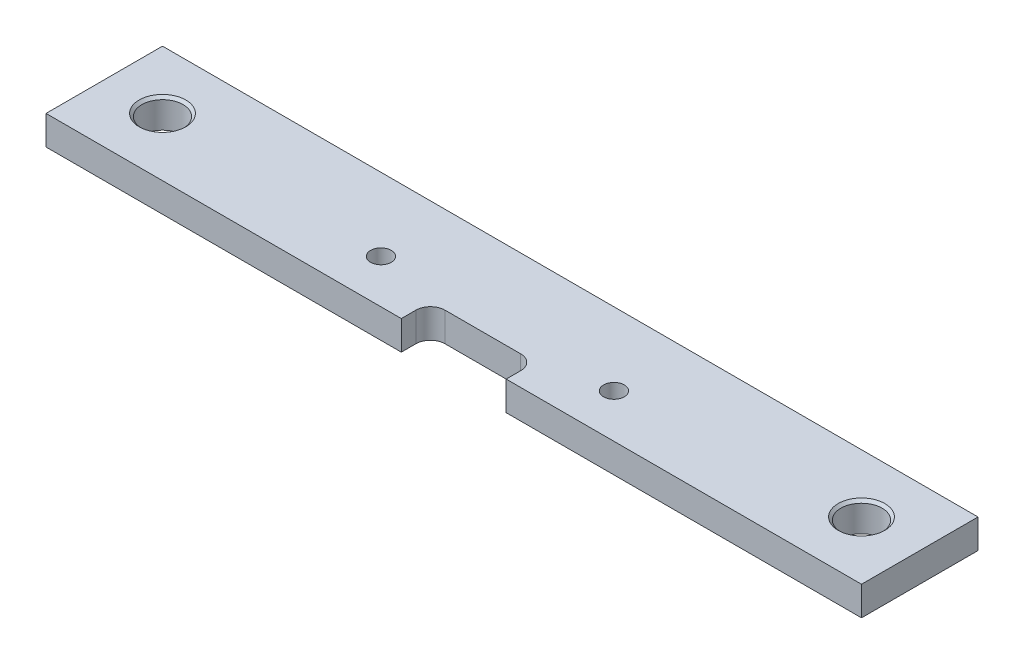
SolidWorks part; units mm, degrees
ref_plane "Front" through (0, 0, 0) normal (0, 0, 1) x (1, 0, 0)
ref_plane "Top" through (0, 0, 0) normal (0, 1, 0) x (1, 0, 0)
ref_plane "Right" through (0, 0, 0) normal (1, 0, 0) x (0, 0, -1)
sketch "Sketch24" plane through (0, 0, 0) normal (0, 1, 0) x (1, 0, 0)
  line L1 (-44.45, 6.35) -> (44.45, 6.35)
  line L2 (-44.45, 6.35) -> (-44.45, -6.35)
  line L3 (-44.45, -6.35) -> (44.45, -6.35)
  line L4 (44.45, 6.35) -> (44.45, -6.35)
  line L5 (-44.45, 6.35) -> (44.45, -6.35) construction
  line L6 (-44.45, -6.35) -> (44.45, 6.35) construction
  point P0 (0, 0)
  dimension "D1" = 88.9
  dimension "D2" = 12.7
extrude "Boss-Extrude3" add sketch "Sketch24" along normal blind 3.175
hole_wizard "#8 Clearance Hole1" positions "Sketch26" profile "Sketch27" hole size "#8" standard "Ansi Inch"
sketch "Sketch26" plane through (0, 3.175, 0) normal (0, 1, 0) x (-1, 0, 0)
  point P0 (38.1, 0)
  point P1 (-38.1, 0)
  dimension "D1" = 38.1
  dimension "D2" = 38.1
sketch "Sketch27" plane through (-38.1, 3.175, 0) normal (1, 0, 0) x (0, 0, 1)
  line L0 (0, 0) -> (0, 3.175)
  line L1 (0, 3.175) -> (2.2479, 3.175)
  line L2 (2.2479, 3.175) -> (2.2479, 0.2921)
  line L3 (2.2479, 0.2921) -> (2.54, 0)
  line L5 (2.54, 0) -> (0, 0)
  line L6 (-2.2479, 0.2921) -> (-2.54, 0) construction
  line L11 (0, -6.35) -> (0, 107.95) construction
  dimension "Thru Hole Dia." = 4.4958
  dimension "Thru Hole Depth" = 3.175
  dimension "Near C'Sink Dia." = 5.08
  dimension "Near C'Sink Angle" = 90
hole_wizard "#4-40 Tapped Hole2" positions "Sketch29" profile "Sketch28" tap size "#4-40" standard "Ansi Inch"
sketch "Sketch29" plane through (0, 3.175, 0) normal (0, 1, 0) x (-1, 0, 0)
  point P0 (12.7, 1.5875)
  point P1 (-12.7, 1.5875)
  dimension "D1" = 1.5875
  dimension "D2" = 12.7
  dimension "D3" = 12.7
sketch "Sketch28" plane through (-12.7, 3.175, 1.5875) normal (1, 0, 0) x (0, 0, 1)
  line L0 (0, 0) -> (0, 3.175)
  line L1 (0, 3.175) -> (1.1303, 3.175)
  line L2 (1.1303, 3.175) -> (1.1303, 0)
  line L5 (1.1303, 0) -> (0, 0)
  line L11 (0, -6.35) -> (0, 107.95) construction
  dimension "Thread Major Dia." = 2.2606
  dimension "Thru Tap Drill Depth" = 3.175
sketch "Sketch30" plane through (0, 3.175, 0) normal (0, 1, 0) x (1, 0, 0)
  line L0 (-44.45, -6.35) -> (44.45, -6.35) construction
  line L1 (-5.715, -3.175) -> (5.715, -3.175)
  line L2 (-5.715, -3.175) -> (-5.715, -9.525)
  line L3 (-5.715, -9.525) -> (5.715, -9.525)
  line L4 (5.715, -3.175) -> (5.715, -9.525)
  line L5 (-5.715, -3.175) -> (5.715, -9.525) construction
  line L6 (-5.715, -9.525) -> (5.715, -3.175) construction
  point P0 (0, -6.35)
  dimension "D1" = 11.43
  dimension "D2" = 6.35
extrude "Cut-Extrude6" cut sketch "Sketch30" against normal through all
fillet "Fillet2" radius 1.5875 2 edges at (5.715, 1.5875, 3.175) (-5.715, 1.5875, 3.175)
sketch "Sketch32" plane through (0, 0, 0) normal (0, 0, 1) x (1, 0, 0)
  line L0 (0, 0) -> (0, 3.175)
  line L1 (0, 3.175) -> (23.7666, 3.175)
  line L2 (23.7666, 3.175) -> (44.45, 15.6029)
  line L4 (44.45, 15.6029) -> (65.1334, 3.175)
  line L5 (65.1334, 3.175) -> (88.9, 3.175)
  line L6 (88.9, 3.175) -> (88.9, 0)
  line L7 (88.9, 0) -> (0, 0)
  dimension "D1" = 3.175
  dimension "D2" = 149
  dimension "D3" = 88.9
  dimension "D5" = 24.13
extrude "Boss-Extrude4" [suppressed] add sketch "Sketch32" along normal blind 12.7
hole_wizard "#8 Clearance Hole2" positions "Sketch35" profile "Sketch34" hole size "#8" standard "Ansi Inch"
sketch "Sketch35" [suppressed] plane through (0, 3.175, 0) normal (0, 1, 0) x (-1, 0, 0)
  line L7 (0, 6.35) -> (-23.7666, 6.35) construction
  line L8 (0, 12.7) -> (0, 0) construction
  line L9 (-23.7666, 12.7) -> (-23.7666, 0) construction
  line L11 (-44.45, 0) -> (-44.45, 12.7) construction
  line L15 (-6.35, 6.35) -> (-44.45, 6.35) construction
  line L17 (-44.45, 6.35) -> (-82.55, 6.35) construction
  point P0 (-6.35, 6.35)
  point P1 (-82.55, 6.35)
  dimension "D1" = 76.2
sketch "Sketch34" plane through (6.35, 3.175, 6.35) normal (1, 0, 0) x (0, 0, 1)
  line L0 (0, 0) -> (0, 3.175)
  line L1 (0, 3.175) -> (2.2479, 3.175)
  line L2 (2.2479, 3.175) -> (2.2479, 0)
  line L5 (2.2479, 0) -> (0, 0)
  line L11 (0, -6.35) -> (0, 107.95) construction
  dimension "Thru Hole Dia." = 4.4958
  dimension "Thru Hole Depth" = 3.175
sketch "Sketch40" [suppressed] plane through (0, 0, 12.7) normal (0, 0, 1) x (1, 0, 0)
  line L0 (44.45, 0) -> (44.45, 9.7622) construction
  line L1 (36.83, 0) -> (52.07, 0)
  line L2 (36.83, 0) -> (36.83, 3.81)
  line L3 (36.83, 3.81) -> (52.07, 3.81)
  line L4 (52.07, 3.81) -> (52.07, 0)
  line L6 (44.45, 0) -> (44.45, 3.81) construction
  dimension "D1" = 15.24
  dimension "D2" = 3.81
extrude "Cut-Extrude7" [suppressed] cut sketch "Sketch40" against normal blind 5.08
fillet "Fillet3" [suppressed] radius 1.27
hole_wizard "#4-40 Tapped Hole3" positions "Sketch37" profile "Sketch36" tap size "#4-40" standard "Ansi Inch"
sketch "Sketch37" [suppressed] plane through (4.9027, -8.1595, 0) normal (-0.515, 0.8572, 0) x (-0.8572, -0.515, 0)
  line L0 (-34.0722, 0) -> (-34.0722, 12.7) construction
  line L1 (-46.1372, 0) -> (-22.0072, 0) construction
  line L2 (-46.1372, 12.7) -> (-22.0072, 12.7) construction
  point P0 (-34.0722, 10.16)
  dimension "D1" = 2.54
sketch "Sketch36" plane through (34.1083, 9.3889, 10.16) normal (0, 0, 1) x (-0.8572, -0.515, 0)
  line L0 (0, 0) -> (0, 11.2202)
  line L1 (0, 11.2202) -> (1.1303, 10.541)
  line L2 (1.1303, 10.541) -> (1.1303, 0)
  line L5 (1.1303, 0) -> (0, 0)
  line L10 (0, 11.2202) -> (-1.1303, 10.541) construction
  line L11 (0, -6.35) -> (0, 107.95) construction
  dimension "Tap Drill Dia." = 2.2606
  dimension "Tap Drill Depth" = 10.541
  dimension "Drill Angle" = 118
hole_wizard "#4-40 Tapped Hole4" positions "Sketch39" profile "Sketch38" tap size "#4-40" standard "Ansi Inch"
sketch "Sketch39" [suppressed] plane through (18.6793, 31.0875, 0) normal (0.515, 0.8572, 0) x (-0.8572, 0.515, 0)
  line L0 (-42.13, 12.7) -> (-42.13, 0) construction
  line L1 (-54.195, 12.7) -> (-30.065, 12.7) construction
  line L2 (-54.195, 0) -> (-30.065, 0) construction
  point P0 (-42.13, 10.16)
  dimension "D1" = 2.54
sketch "Sketch38" plane through (54.7917, 9.3889, 10.16) normal (0, 0, 1) x (-0.8572, 0.515, 0)
  line L0 (0, 0) -> (0, 11.2202)
  line L1 (0, 11.2202) -> (1.1303, 10.541)
  line L2 (1.1303, 10.541) -> (1.1303, 0)
  line L5 (1.1303, 0) -> (0, 0)
  line L10 (0, 11.2202) -> (-1.1303, 10.541) construction
  line L11 (0, -6.35) -> (0, 107.95) construction
  dimension "Tap Drill Dia." = 2.2606
  dimension "Tap Drill Depth" = 10.541
  dimension "Drill Angle" = 118
hole_wizard "#4-40 Tapped Hole5" positions "Sketch46" profile "Sketch45" tap size "#4-40" standard "Ansi Inch"
sketch "Sketch46" [suppressed] plane through (0, 3.175, 0) normal (0, 1, 0) x (-1, 0, 0)
  line L0 (-23.7666, 12.7) -> (0, 12.7) construction
  line L1 (-23.7666, 12.7) -> (-23.7666, 0) construction
  line L2 (-88.9, 12.7) -> (-65.1334, 12.7) construction
  line L3 (-65.1334, 12.7) -> (-65.1334, 0) construction
  point P0 (-16.1466, 10.16)
  point P1 (-72.7534, 10.16)
  dimension "D1" = 2.54
  dimension "D2" = 7.62
  dimension "D3" = 2.54
  dimension "D4" = 7.62
sketch "Sketch45" plane through (16.1466, 3.175, 10.16) normal (1, 0, 0) x (0, 0, 1)
  line L0 (0, 0) -> (0, 3.175)
  line L1 (0, 3.175) -> (1.1303, 3.175)
  line L2 (1.1303, 3.175) -> (1.1303, 0)
  line L5 (1.1303, 0) -> (0, 0)
  line L11 (0, -6.35) -> (0, 107.95) construction
  dimension "Thru Tap Drill Dia." = 2.2606
  dimension "Thru Tap Drill Depth" = 3.175
sketch "Sketch41" [suppressed] plane through (0, 0, 12.7) normal (0, 0, 1) x (1, 0, 0)
  line L0 (0, 0) -> (0, 3.175)
  line L1 (0, 3.175) -> (-10.033, 3.175)
  line L2 (-10.033, 3.175) -> (-10.033, -3.683)
  line L3 (-10.033, -3.683) -> (-6.858, -3.683)
  line L4 (-6.858, -3.683) -> (-6.858, 0)
  line L5 (-6.858, 0) -> (0, 0)
  dimension "D1" = 6.858
  dimension "D2" = 3.175
  dimension "D3" = 6.858
extrude "Boss-Extrude5" [suppressed] add sketch "Sketch41" against normal through all
fillet "Fillet4" [suppressed] radius 1.27
sketch "Sketch42" [suppressed] plane through (0, -3.683, 0) normal (0, -1, 0) x (1, 0, 0)
  line L1 (-6.858, 0) -> (-25.908, 0)
  line L2 (-6.858, 0) -> (-6.858, 12.7)
  line L3 (-6.858, 12.7) -> (-25.908, 12.7)
  line L4 (-25.908, 0) -> (-25.908, 12.7)
  dimension "D1" = 19.05
extrude "Boss-Extrude6" [suppressed] add sketch "Sketch42" along normal blind 2.54
sketch "Sketch44" [suppressed] plane through (0, -3.683, 0) normal (0, 1, 0) x (1, 0, 0)
  line L0 (-25.908, -6.35) -> (-10.033, -6.35) construction
  line L1 (-25.908, -12.7) -> (-25.908, 0) construction
  line L2 (-10.033, 0) -> (-10.033, -12.7) construction
  line L3 (-13.081, -3.4827) -> (-13.081, -9.2173)
  arc A0 (-13.081, -3.4827) -> (-13.081, -9.2173) centre (-17.9705, -6.35) ccw
  dimension "D1" = 11.3364
  dimension "D2" = 4.8895
extrude "Cut-Extrude8" [suppressed] cut sketch "Sketch44" against normal through all
fillet "Fillet8" [suppressed] radius 0.508
